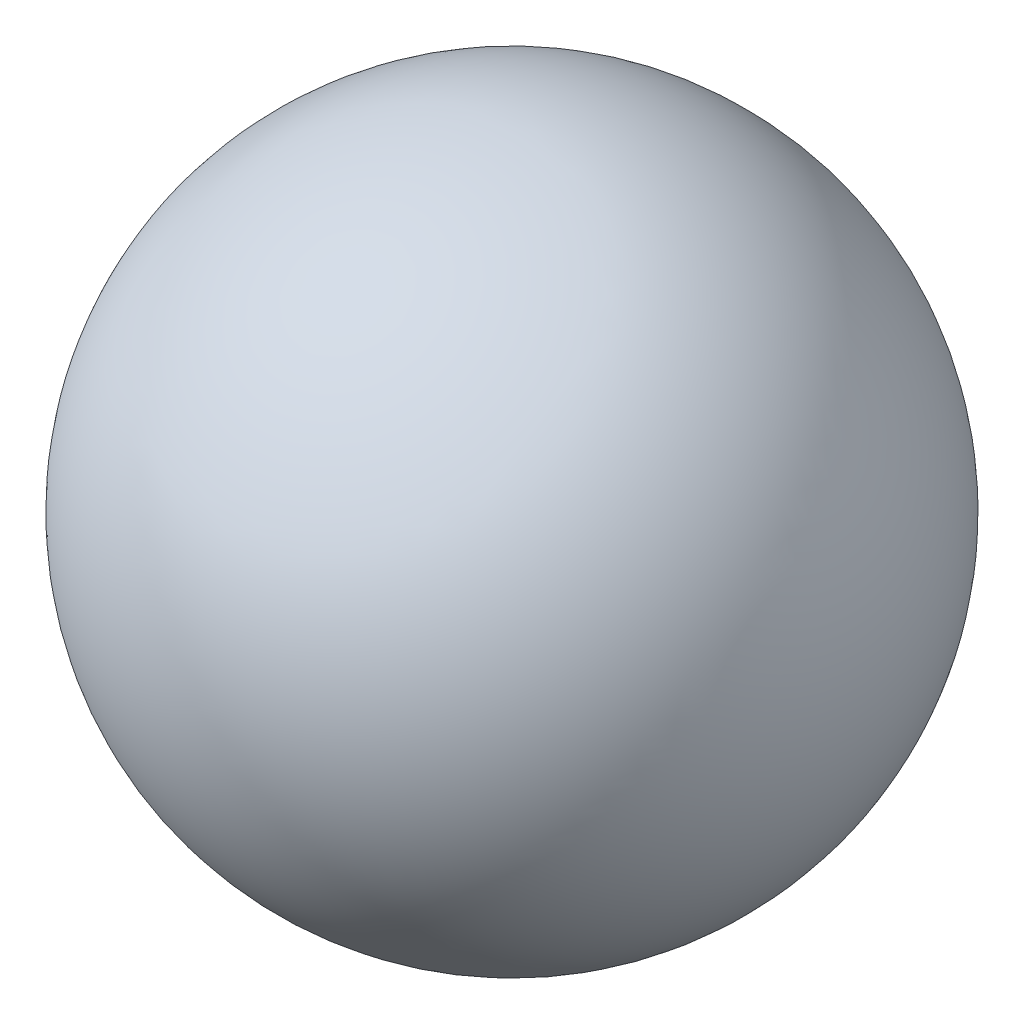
SolidWorks part; units mm, degrees
ref_plane "Front Plane" through (0, 0, 0) normal (0, 0, 1) x (1, 0, 0)
ref_plane "Top Plane" through (0, 0, 0) normal (0, 1, 0) x (1, 0, 0)
ref_plane "Right Plane" through (0, 0, 0) normal (1, 0, 0) x (0, 0, -1)
sketch "Sketch3" plane through (0, 0, 0) normal (0, 0, 1) x (1, 0, 0)
  line L0 (0, 0) -> (25.4, 0)
  dimension "D1" = 25.4
sketch "Sketch4" plane through (0, 0, 0) normal (0, 0, 1) x (1, 0, 0)
  line L0 (0, 0) -> (25.4, 0) construction
  line L1 (0, 0) -> (25.4, 0)
  arc A0 (0, 0) -> (25.4, 0) centre (12.7, 0) ccw
revolve "Revolve6" add sketch "Sketch4" angle 360 about L0
